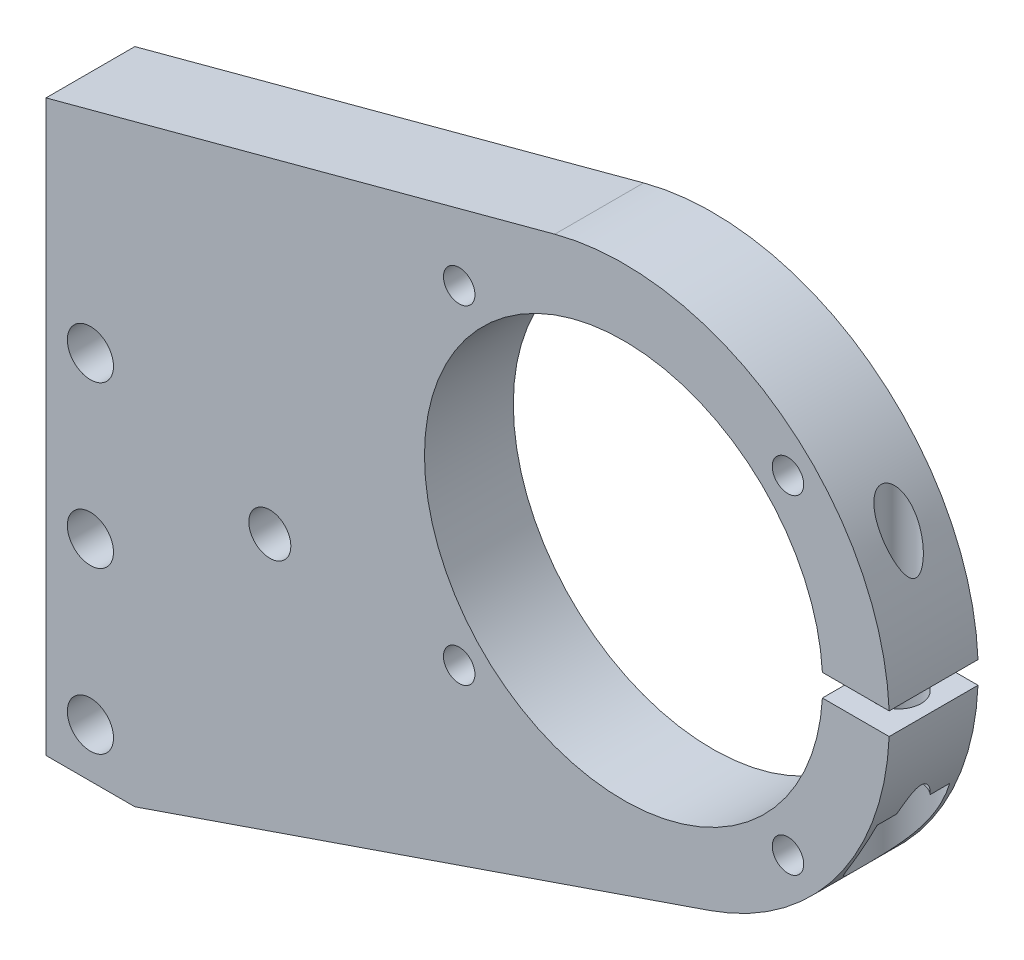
SolidWorks part; units mm, degrees
ref_plane "Front Plane" through (0, 0, 0) normal (0, 0, 1) x (1, 0, 0)
ref_plane "Top Plane" through (0, 0, 0) normal (0, 1, 0) x (1, 0, 0)
ref_plane "Right Plane" through (0, 0, 0) normal (1, 0, 0) x (0, 0, -1)
ref_plane "Plane1" through (0, 0, 0) normal (0, 0, -1) x (-1, 0, 0)
sketch "Sketch1" plane through (0, 0, 0) normal (0, 0, -1) x (-1, 0, 0)
  line L0 (224.1695, 127.7225) -> (151.4352, 147.2116)
  line L1 (129.2465, 74.5705) -> (211.4695, 46.305)
  line L2 (211.4695, 46.305) -> (224.1695, 46.305)
  line L3 (224.1695, 46.305) -> (224.1695, 127.7225)
  arc A0 (151.4352, 147.2116) -> (129.2465, 74.5705) centre (141.6001, 110.5064) ccw
extrude "Boss-Extrude1" add sketch "Sketch1" against normal blind 12.7
sketch "Sketch2" plane through (0, 0, 12.7) normal (0, 0, 1) x (1, 0, 0)
  line L0 (-103.6333, 112.0939) -> (-113.179, 112.0939)
  line L1 (-113.179, 108.9189) -> (-103.6333, 108.9189)
  arc A0 (-103.6333, 108.9189) -> (-103.6333, 112.0939) centre (-141.6001, 110.5064) ccw
  arc A1 (-113.179, 112.0939) -> (-113.179, 108.9189) centre (-141.6001, 110.5064) cw
extrude "Cut-Extrude1" cut sketch "Sketch2" against normal through all
ref_plane "Plane2" through (0, 110.5064, 0) normal (0, 1, 0) x (1, 0, 0)
sketch "Sketch3" plane through (0, 110.5064, 0) normal (0, 1, 0) x (1, 0, 0)
  line L0 (-113.1347, 0) -> (-141.6001, 0)
  line L1 (-141.6001, 0) -> (-141.6001, -12.7)
  line L2 (-141.6001, -12.7) -> (-113.1347, -12.7)
  line L3 (-113.1347, -12.7) -> (-113.1347, 0)
  line L4 (-141.6001, 0) -> (-141.6001, -12.7) construction
revolve "Cut-Revolve1" cut sketch "Sketch3" angle 360 about L4
hole_wizard "#8 Clearance Hole1" positions "Sketch5" profile "Sketch4" hole size "#8" standard "ANSI Inch"
sketch "Sketch5" plane through (0, 0, 12.7) normal (0, 0, 1) x (1, 0, 0)
  point P0 (-118.1001, 87.0064)
  point P1 (-165.1001, 87.0064)
  point P2 (-165.1001, 134.0064)
  point P3 (-118.1001, 134.0064)
sketch "Sketch4" plane through (-118.1001, 87.0064, 12.7) normal (1, 0, 0) x (0, -1, 0)
  line L0 (0, 0) -> (0, 12.7)
  line L1 (0, 12.7) -> (2.25, 12.7)
  line L2 (2.25, 12.7) -> (2.25, 0)
  line L5 (2.25, 0) -> (0, 0)
  line L11 (0, -6.35) -> (0, 107.95) construction
  dimension "Thru Hole Dia." = 4.5
  dimension "Thru Hole Depth" = 12.7
hole_wizard "1/4 Clearance Hole1" positions "Sketch7" profile "Sketch6" hole size "1/4" standard "ANSI Inch"
sketch "Sketch7" plane through (0, 0, 0) normal (0, 0, -1) x (-1, 0, 0)
  point P0 (217.8195, 53.305)
  point P1 (217.8195, 76.305)
  point P2 (217.8195, 99.305)
sketch "Sketch6" plane through (-217.8195, 53.305, 0) normal (1, 0, 0) x (0, 1, 0)
  line L0 (0, 0) -> (0, 12.7)
  line L1 (0, 12.7) -> (3.3, 12.7)
  line L2 (3.3, 12.7) -> (3.3, 0)
  line L5 (3.3, 0) -> (0, 0)
  line L11 (0, -6.35) -> (0, 107.95) construction
  dimension "Thru Hole Dia." = 6.6
  dimension "Thru Hole Depth" = 12.7
hole_wizard "#12 Clearance Hole1" positions "Sketch9" profile "Sketch8" hole size "#12" standard "ANSI Inch"
sketch "Sketch9" plane through (0, 0, 12.7) normal (0, 0, 1) x (1, 0, 0)
  point P0 (-192.1695, 89.7225)
sketch "Sketch8" plane through (-192.1695, 89.7225, 12.7) normal (1, 0, 0) x (0, -1, 0)
  line L0 (0, 0) -> (0, 12.7)
  line L1 (0, 12.7) -> (3, 12.7)
  line L2 (3, 12.7) -> (3, 0)
  line L5 (3, 0) -> (0, 0)
  line L11 (0, -6.35) -> (0, 107.95) construction
  dimension "Thru Hole Dia." = 6
  dimension "Thru Hole Depth" = 12.7
ref_plane "Plane3" through (0, 84.1425, 0) normal (0, -1, 0) x (-1, 0, 0)
hole_wizard "Hole1" positions "Sketch11" profile "Sketch10" legacy
sketch "Sketch11" plane through (0, 84.1425, 0) normal (0, -1, 0) x (-1, 0, 0)
  point P0 (108.6333, -6.35)
sketch "Sketch10" plane through (-108.6333, 84.1425, 6.35) normal (1, 0, 0) x (0, 0, -1)
  line L0 (0, 0) -> (0, 24.7764)
  line L1 (0, 24.7764) -> (3.2, 24.7764)
  line L2 (3.2, 24.7764) -> (3.2, 11.7764)
  line L3 (3.2, 11.7764) -> (5.6, 11.7764)
  line L4 (5.6, 11.7764) -> (5.6, 0)
  line L5 (5.6, 0) -> (0, 0)
  line L6 (0, 110) -> (0, -10) construction
  dimension "Diameter" = 6.4
  dimension "Depth" = 24.7764
  dimension "C-Bore Diameter" = 11.2
  dimension "C-Bore Depth" = 11.7764
hole_wizard "#10 Clearance Hole1" positions "Sketch13" profile "Sketch12" hole size "#10" standard "ANSI Inch"
sketch "Sketch13" plane through (0, 112.0939, 0) normal (0, -1, 0) x (-1, 0, 0)
  point P0 (108.6333, -6.35)
sketch "Sketch12" plane through (-108.6333, 112.0939, 6.35) normal (1, 0, 0) x (0, 0, -1)
  line L0 (0, 0) -> (0, 36.4125)
  line L1 (0, 36.4125) -> (2.5, 36.4125)
  line L2 (2.5, 36.4125) -> (2.5, 0)
  line L5 (2.5, 0) -> (0, 0)
  line L11 (0, -6.35) -> (0, 107.95) construction
  dimension "Thru Hole Dia." = 5
  dimension "Thru Hole Depth" = 36.4125
chamfer "Chamfer1" distance 3 angle 45 3 edges at (-221.1195, 53.305, 0) (-221.1195, 76.305, 0) (-221.1195, 99.305, 0)
